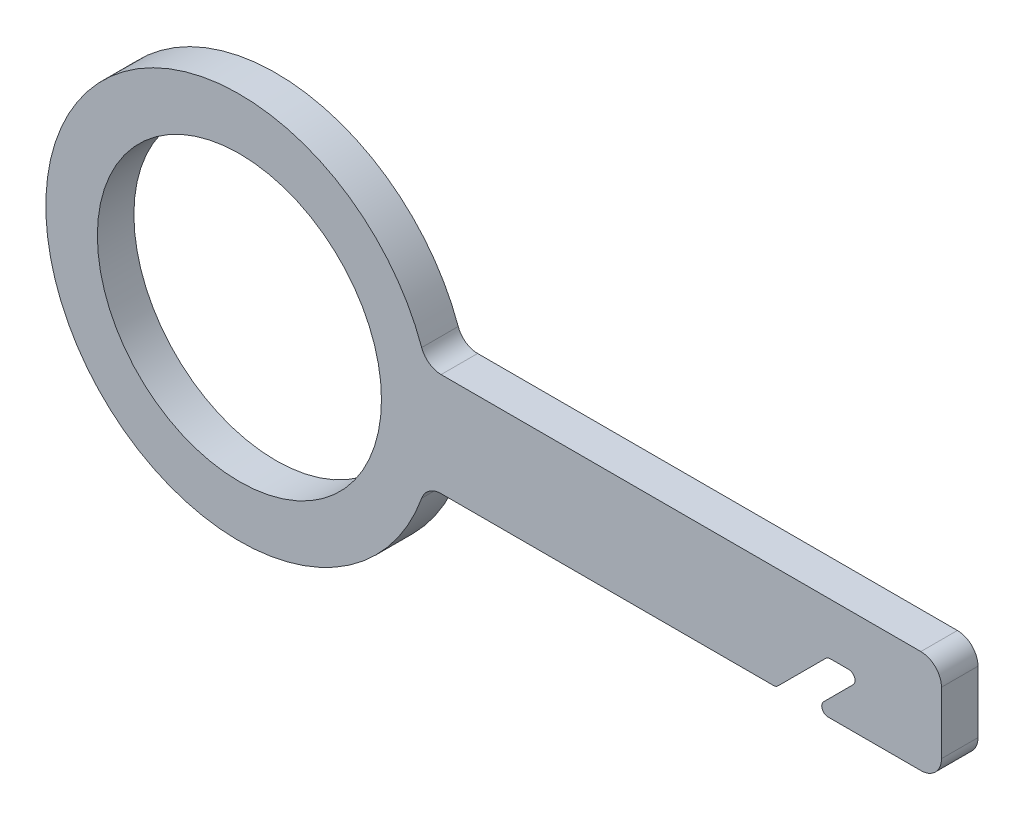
SolidWorks part; units mm, degrees
ref_plane "Front Plane" through (0, 0, 0) normal (0, 0, 1) x (1, 0, 0)
ref_plane "Top Plane" through (0, 0, 0) normal (0, 1, 0) x (1, 0, 0)
ref_plane "Right Plane" through (0, 0, 0) normal (1, 0, 0) x (0, 0, -1)
sketch "Sketch1" plane through (0, 0, 0) normal (0, 0, 1) x (1, 0, 0)
  line L0 (22.9891, 6.35) -> (86.4891, 6.35)
  line L1 (86.4891, 6.35) -> (86.4891, -6.35)
  line L2 (86.4891, -6.35) -> (22.9891, -6.35)
  line L3 (66.1141, -6.35) -> (72.4641, 0)
  line L4 (70.6141, -6.35) -> (66.1141, -6.35)
  line L5 (72.4641, 0) -> (76.9641, 0)
  line L6 (76.9641, 0) -> (70.6141, -6.35)
  circle A0 centre (0, 0) radius 17.5
  circle A2 centre (0, 0) radius 23.85
  dimension "D1" = 6.35
  dimension "D5" = 45
  dimension "D2" = 12.7
  dimension "D3" = 0
  dimension "D4" = 63.5
  dimension "D6" = 4.5
  dimension "D7" = 4.5
  dimension "D8" = 9.525
extrude "Boss-Extrude2" add sketch "Sketch1" along normal blind 4.5 contours A2 A0 | A2 L2 L3 L5 L6 L1 L0
fillet "Fillet3" radius 2.54 4 edges at (22.9891, 6.35, 2.25) (86.4891, 6.35, 2.25) (86.4891, -6.35, 2.25) (22.9891, -6.35, 2.25)
fillet "Fillet4" radius 0.7937 4 edges at (70.6141, -6.35, 2.25) (66.1141, -6.35, 2.25) (72.4641, 0, 2.25) (76.9641, 0, 2.25)
